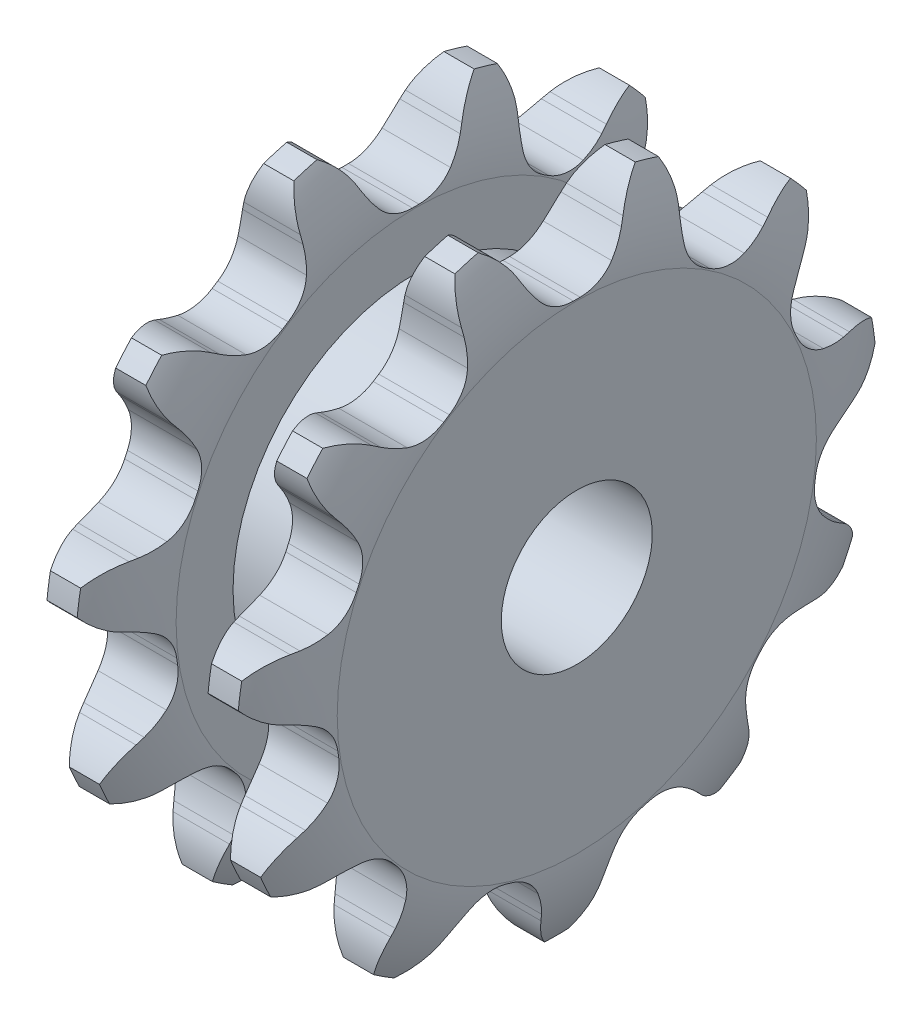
SolidWorks part; units mm, degrees
ref_plane "Plane1" through (0, 0, 0) normal (0, 0, 1) x (1, 0, 0)
ref_plane "Plane2" through (0, 0, 0) normal (0, 1, 0) x (1, 0, 0)
ref_plane "Plane3" through (0, 0, 0) normal (1, 0, 0) x (0, 0, -1)
sketch "Clipboard" plane through (0, 0, 0) normal (0, 1, 0) x (1, 0, 0)
  line L0 (0, 0) -> (6.2333, -1.2116)
  line L1 (-15, 0) -> (100, 0) construction
  line L2 (0, 0) -> (-0.5301, 0.5991)
  line L3 (0, 0) -> (-2.9891, 1.1425)
  line L4 (0, 0) -> (3.043, 0.5915)
  line L5 (0, 0) -> (-89.0105, -33.1983)
  line L6 (0, 0) -> (-7.6265, -5.1456)
  line L7 (-0.5301, 0.5991) -> (92.0355, 21.9696)
  line L8 (-76.2, 38.1) -> (-75.2, 38.1)
  line L9 (-73.2358, 39.4872) -> (-73.0836, 39.4947)
  line L10 (-73.0533, 76.1892) -> (-66.6533, 76.1892)
  circle A0 centre (0, 0) radius 1.651
  circle A1 centre (0, 0) radius 4
  circle A2 centre (0, 0) radius 4
  dimension "Dr" = 3.302
  dimension "MHD" = 8
  dimension "Hub_dia" = 8
  dimension "Num_teeth" = 11
  dimension "Pitch" = 6.35
  dimension "Width" = 3.1
  dimension "Chamfer_wid" = 0.8
  dimension "Chamfer_dep" = 3.2
  dimension "Overall_len" = 95
  dimension "Show_teeth" = 11
  dimension "Thickness" = 9.2
  dimension "OAL" = 95.0005
  dimension "T_dim" = 1
  dimension "Width_const_x" = 0.1524
  dimension "Face_width" = 2.8
  dimension "Num_strands" = 2
  dimension "Transv_pitch" = 6.4
sketch "BasProSke" plane through (0, 0, 0) normal (0, 1, 0) x (1, 0, 0)
  line L0 (-10, 0) -> (60, 0) construction
  line L1 (0, 0) -> (0, 9.5181)
  line L2 (0, 0) -> (9.2, 0)
  line L3 (9.2, 0) -> (9.2, 9.5181)
  line L4 (8.4, 12.7181) -> (0.8, 12.7181)
  arc A0 (0, 9.5181) -> (0.8, 12.7181) centre (6.8, 9.5181) cw
  arc A1 (9.2, 9.5181) -> (8.4, 12.7181) centre (2.4, 9.5181) ccw
  dimension "D1" = 6.8
  dimension "G1" = 0.8
  dimension "G2" = 0.8
  dimension "H2" = 3.2
  dimension "Diameter" = 25.4361
  dimension "H1" = 3.2
  dimension "Thickness" = 9.2
revolve "Base-Revolve" add sketch "BasProSke" angle 360 about L0
sketch "GrvSke" plane through (0, 0, 0) normal (0, 1, 0) x (1, 0, 0)
  line L0 (2.8, 9.5181) -> (2.8, 7.2571)
  line L1 (2.8, 7.2571) -> (6.4, 7.2571)
  line L2 (6.4, 7.2571) -> (6.4, 9.5181)
  line L3 (2, 12.7181) -> (7.2, 12.7181)
  line L4 (4.6, 0) -> (4.6, 52.07) construction
  line L5 (-10, 0) -> (60, 0) construction
  line L6 (0, 0) -> (35.56, 0) construction
  arc A0 (6.4, 9.5181) -> (7.2, 12.7181) centre (13.2, 9.5181) cw
  arc A1 (2.8, 9.5181) -> (2, 12.7181) centre (-4, 9.5181) ccw
  dimension "Diameter" = 25.4361
  dimension "H1" = 3.2
  dimension "Grv_diam" = 14.5141
  dimension "Grv_width" = 3.6
  dimension "Offset" = 4.6
  dimension "G1" = 0.8
revolve "Groove" cut sketch "GrvSke" angle 360 about L6
pattern_linear "Grooves" [suppressed]
sketch "TooCutSke" plane through (0, 0, 0) normal (1, 0, 0) x (0, 0, -1)
  line L0 (1.9692, 10.9762) -> (2.1109, 11.2478)
  line L1 (0, 0) -> (0, 107) construction
  line L2 (0.2483, 11.2688) -> (-2.0258, 11.2688) construction
  line L4 (0.1322, 12.3974) -> (0.1322, 8.6148) construction
  line L5 (0.1322, 9.5714) -> (-0.1322, 9.5714)
  line L6 (-1.9692, 10.9762) -> (-2.1109, 11.2478)
  arc A0 (1.4237, 10.1675) -> (1.9692, 10.9762) centre (-1.8779, 12.9828) ccw
  arc A1 (1.4237, 10.1675) -> (0.1322, 9.5714) centre (0.1322, 11.2688) cw
  arc A2 (2.1109, 11.2478) -> (4.5677, 12.7373) centre (4.5677, 9.9664) cw
  arc A3 (-0.1322, 9.5714) -> (-1.4237, 10.1675) centre (-0.1322, 11.2688) cw
  arc A4 (-1.4237, 10.1675) -> (-1.9692, 10.9762) centre (1.8779, 12.9828) cw
  arc A5 (-2.1109, 11.2478) -> (-4.5677, 12.7373) centre (-4.5677, 9.9664) ccw
  arc A6 (4.5677, 12.7373) -> (-4.5677, 12.7373) centre (0, 0) ccw
  dimension "D1" = 1.8779
  dimension "R" = 1.6974
  dimension "E" = 4.339
  dimension "F" = 2.7709
  dimension "Pitch_radius" = 11.2696
  dimension "W" = 4.5677
  dimension "V" = 1.3024
  dimension "Half_U" = 0.1322
  dimension "A" = 40.455
  dimension "B" = 12.909
extrude "ToothCut" cut sketch "TooCutSke" along normal through all
pattern_circular "TeethCuts" count 11 every 32.727 about axis through (-10, 0, 0) along (1, 0, 0) of "ToothCut"
sketch "HubNeaOneSke" plane through (0, 0, 0) normal (-1, 0, 0) x (0, 0, 1)
  circle A0 centre (0, 0) radius 4
  dimension "Diameter" = 8
extrude "HubNearOne" [suppressed] add sketch "HubNeaOneSke" along normal blind 85.8005
sketch "HubNeaBotSke" plane through (0, 0, 0) normal (-1, 0, 0) x (0, 0, 1)
  circle A0 centre (0, 0) radius 4
  dimension "Diameter" = 8
extrude "HubNearBoth" [suppressed] add sketch "HubNeaBotSke" along normal blind 42.9002
ref_plane "FarPln" through (9.2, 0, 0) normal (1, 0, 0) x (0, 0, -1)
sketch "HubFarSke" plane through (9.2, 0, 0) normal (1, 0, 0) x (0, 0, -1)
  circle A0 centre (0, 0) radius 4
  dimension "Diameter" = 8
extrude "HubFar" [suppressed] add sketch "HubFarSke" along normal blind 42.9002
sketch "BorSke" plane through (0, 0, 0) normal (1, 0, 0) x (0, 0, -1)
  circle A0 centre (0, 0) radius 3
  dimension "Diameter" = 6
extrude "Bore" cut sketch "BorSke" along normal mid plane 190.001
sketch "KeySke" plane through (0, 0, 0) normal (1, 0, 0) x (0, 0, -1)
  line L0 (-1, 0) -> (-1, 4)
  line L1 (-1, 4) -> (1, 4)
  line L2 (1, 4) -> (1, 0)
  line L3 (0, 0) -> (0, 34) construction
  line L4 (-1, 0) -> (1, 0)
  dimension "Offset" = 4
  dimension "Width" = 2
extrude "Keyway" [suppressed] cut sketch "KeySke" along normal mid plane 190.001
pattern_circular "Keyway2" [suppressed] count 2 every 90 about axis through (-10, 0, 0) along (1, 0, 0)
equation "' \"Pitch@Clipboard\" = 6.35"
equation "' \"Num_strands@Clipboard\" = 2"
equation "' \"Num_teeth@Clipboard\" = 11"
equation "' \"Hub_dia@Clipboard\" = 8"
equation "' \"Overall_len@Clipboard\" = 95"
equation "' \"Diameter@BorSke\" = 6"
equation "' \"T_dim@Clipboard\" = 1"
equation "' \"Width@KeySke\" = 2"
equation "' \"Dr@Clipboard\" = 3.302"
equation "' \"Face_width@Clipboard\" = 2.8"
equation "' \"Chamfer_dep@Clipboard\" = 3.2"
equation "' \"Chamfer_wid@Clipboard\" = 0.8"
equation "' \"Transv_pitch@Clipboard\" = 6.4"
equation "' \"Show_teeth@Clipboard\" = 11"
equation "\"Num_teeth@Clipboard\" = int( \"Num_teeth@Clipboard\" )"
equation "\"Num_teeth@Clipboard\" = ((sgn( \"Num_teeth@Clipboard\" - 5.0)+1)*( \"Num_teeth@Clipboard\" - 5.0))/2 +5.0"
equation "\"Num_teeth@Clipboard\" = ((sgn( \"Num_teeth@Clipboard\" - 200.0)-1)*( \"Num_teeth@Clipboard\" - 200.0))/-2 +200.0"
equation "\"MHD@Clipboard\" = \"Pitch@Clipboard\" * (1.0 / tan(3.14159265 / \"Num_teeth@Clipboard\" ) - 1.0) - 0.762"
equation "\"Thickness@Clipboard\"  = \"Face_width@Clipboard\" + (\"Num_strands@Clipboard\" - 1) * \"Transv_pitch@Clipboard\""
equation "\"OAL@Clipboard\" = \"Thickness@Clipboard\""
equation "\"MHD@Clipboard\" = ((sgn( \"MHD@Clipboard\" - \"Hub_dia@Clipboard\" )-1)*( \"MHD@Clipboard\" - \"Hub_dia@Clipboard\" ))/-2+ \"Hub_dia@Clipboard\""
equation "\"OAL@Clipboard\" = ((sgn( \"OAL@Clipboard\" - \"Overall_len@Clipboard\" )+1)*( \"OAL@Clipboard\" - \"Overall_len@Clipboard\" ))/2 + \"Overall_len@Clipboard\" + 0.0005"
equation "\"Num_teeth@TeethCuts\" = int( \"Show_teeth@Clipboard\" ) + 1"
equation "\"Num_teeth@TeethCuts\" = ((sgn( \"Num_teeth@TeethCuts\" - \"Num_teeth@Clipboard\" )-1)*( \"Num_teeth@TeethCuts\" - \"Num_teeth@Clipboard\" ))/-2+ \"Num_teeth@Clipboard\""
equation "\"Num_teeth@TeethCuts\" = ((sgn( \"Num_teeth@TeethCuts\" - 2.0)+1)*( \"Num_teeth@TeethCuts\" - 2.0))/2 +2.0"
equation "\"Angle@TeethCuts\" = 360.0 / \"Num_teeth@Clipboard\""
equation "\"Pitch_radius@TooCutSke\" = ( \"Pitch@Clipboard\" / 2.0) / sin(3.14159265 / \"Num_teeth@Clipboard\" )  'ma"
equation "\"Half_U@TooCutSke\" = 0.5 * (0.07 * (\"Pitch@Clipboard\" - \"Dr@Clipboard\") + 0.051)"
equation "\"R@TooCutSke\"  = \"Dr@Clipboard\" * 0.5025 + 0.0381"
equation "\"A@TooCutSke\" = 35.0 + (60.0 / \"Num_teeth@Clipboard\")"
equation "\"E@TooCutSke\"  = \"Dr@Clipboard\" * 1.3025 + 0.0381"
equation "\"B@TooCutSke\"  = 18.0 - (56.0 / \"Num_teeth@Clipboard\" )"
equation "\"W@TooCutSke\" = 1.4 * \"Dr@Clipboard\" * cos(3.14159265 / \"Num_teeth@Clipboard\" ) + \"Half_U@TooCutSke\""
equation "\"V@TooCutSke\" = 1.4 * \"Dr@Clipboard\" * sin(3.14159265 / \"Num_teeth@Clipboard\" )"
equation "\"Diameter@BasProSke\" = 2.0 * ( (0.3 * \"Pitch@Clipboard\" ) +  \"Pitch@Clipboard\" / 2.0 / tan(3.14159265 / \"Num_teeth@Clipboard\" ))"
equation "\"Thickness@BasProSke\"  = \"Thickness@Clipboard\""
equation "\"G1@BasProSke\" =  \"Chamfer_wid@Clipboard\""
equation "\"G2@BasProSke\" =  \"Chamfer_wid@Clipboard\""
equation "\"H1@BasProSke\" =  \"Chamfer_dep@Clipboard\""
equation "\"H2@BasProSke\" =  \"Chamfer_dep@Clipboard\""
equation "\"Diameter@GrvSke\" = \"Diameter@BasProSke\""
equation "\"G1@GrvSke\" = \"Chamfer_wid@Clipboard\""
equation "\"H1@GrvSke\" = \"Chamfer_dep@Clipboard\""
equation "\"Grv_diam@GrvSke\" =  \"Pitch@Clipboard\" * (1.0 / tan(3.14159265 / \"Num_teeth@Clipboard\" ) - 1.0) - 0.762"
equation "\"Grv_width@GrvSke\" =  \"Transv_pitch@Clipboard\" - \"Face_width@Clipboard\""
equation "\"Offset@GrvSke\" = \"Grv_width@GrvSke\" / 2.0 + \"Face_width@Clipboard\""
equation "\"Offset@Grooves\" = \"Transv_pitch@Clipboard\""
equation "\"Num_grvs@Grooves\" = \"Num_strands@Clipboard\""
equation "\"Num_grvs@Grooves\" = \"Num_grvs@Grooves\" - 1 * sgn( \"Num_grvs@Grooves\" -1)"
equation "\"Diameter@HubNeaOneSke\" = \"MHD@Clipboard\""
equation "\"Length@HubNearOne\" = \"OAL@Clipboard\" - \"Thickness@BasProSke\""
equation "\"Diameter@HubNeaBotSke\" = \"MHD@Clipboard\""
equation "\"Length@HubNearBoth\" = ( \"OAL@Clipboard\" - \"Thickness@BasProSke\" ) / 2.0"
equation "\"Thickness@FarPln\" = \"Thickness@BasProSke\""
equation "\"Diameter@HubFarSke\" = \"MHD@Clipboard\""
equation "\"Length@HubFar\" = ( \"OAL@Clipboard\" - \"Thickness@BasProSke\" ) / 2.0"
equation "\"D1@Bore\" = \"OAL@Clipboard\" * 2.0"
equation "\"D1@Keyway\" = \"OAL@Clipboard\" * 2.0"
equation "\"Offset@KeySke\" = \"T_dim@Clipboard\" + \"Diameter@BorSke\" / 2.0"
